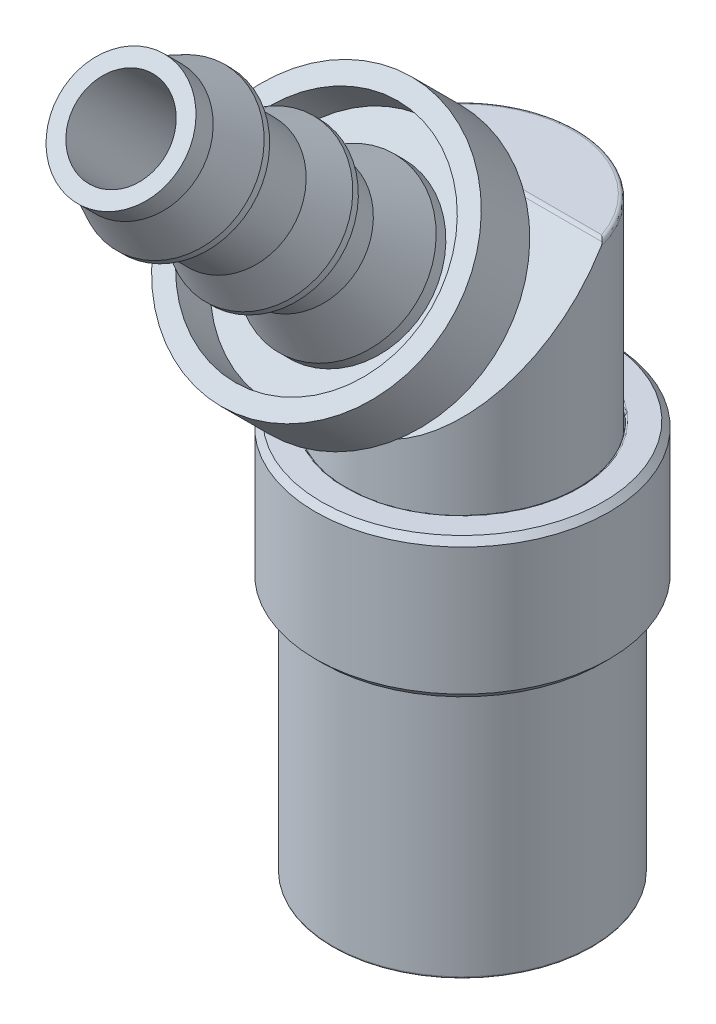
SolidWorks part; units mm, degrees
other "Body_"
ref_plane "Front Plane" through (0, 0, 0) normal (0, 0, 1) x (1, 0, 0)
ref_plane "Top Plane" through (0, 0, 0) normal (0, 1, 0) x (1, 0, 0)
ref_plane "Right Plane" through (0, 0, 0) normal (1, 0, 0) x (0, 0, -1)
imported_body "SC200S"
imported_body "Body"
imported_body "PL-Barb"
imported_body "Sleeve"
imported_body "Barb"
sketch "Sketch1" plane through (0, 0, 0) normal (1, 0, 0) x (0, 0, -1)
  line L0 (-4.7752, 8.1191) -> (-4.7752, 0.7874)
  line L1 (-4.7752, 0.7874) -> (-3.175, 2.3876)
  line L2 (-3.175, 2.3876) -> (-3.175, 7.1952)
  line L3 (-3.175, 7.1952) -> (-4.7752, 8.1191)
  line L4 (0, 7.1493) -> (0, 2.4978) construction
  line L5 (-5.0546, 8.2804) -> (-4.7752, 8.1191) construction
  line L6 (-5.5626, 0) -> (-4.7752, 0.7874) construction
  dimension "D1" = 6.35
revolve "Revolve1" add sketch "Sketch1" angle 360 about L4
sketch "Sketch2" plane through (0, 0, 0) normal (0, -1, 0) x (1, 0, 0)
  line L1 (-4.572, -2.6396) -> (0, -5.2793)
  line L2 (0, -5.2793) -> (4.572, -2.6396)
  line L3 (4.572, -2.6396) -> (4.572, 2.6396)
  line L4 (4.572, 2.6396) -> (0, 5.2793)
  line L5 (0, 5.2793) -> (-4.572, 2.6396)
  line L6 (-4.572, 2.6396) -> (-4.572, -2.6396)
  circle A0 centre (0, 0) radius 4.572 construction
  dimension "D1" = 9.144
extrude "Cut-Extrude1" cut sketch "Sketch2" against normal up to surface (9.3379 mm away)
